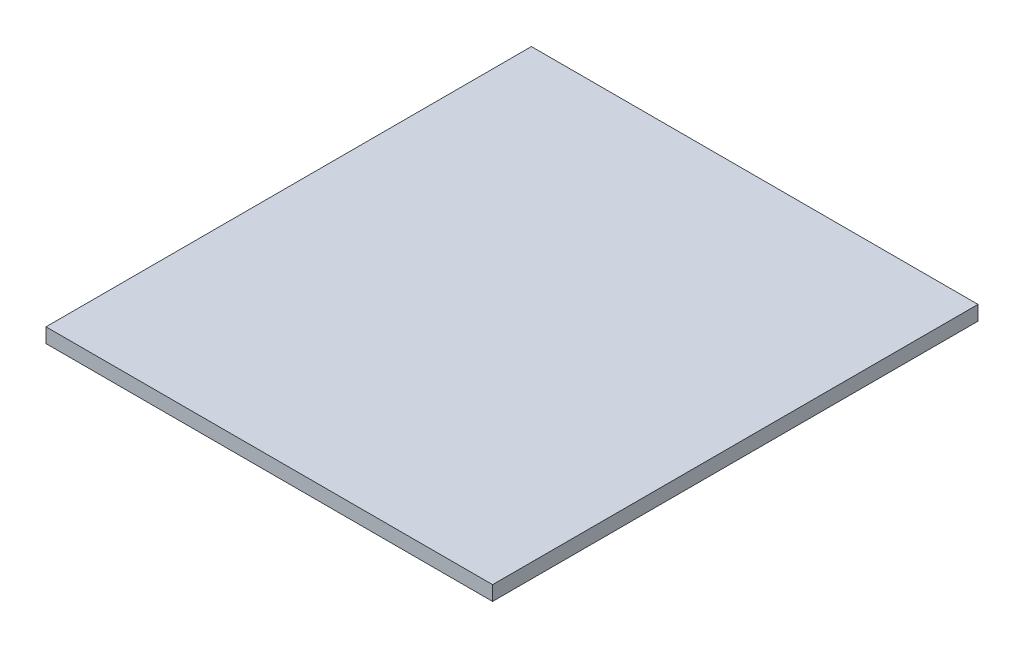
SolidWorks part; units mm, degrees
ref_plane "Front Plane" through (0, 0, 0) normal (0, 0, 1) x (1, 0, 0)
ref_plane "Top Plane" through (0, 0, 0) normal (0, 1, 0) x (1, 0, 0)
ref_plane "Right Plane" through (0, 0, 0) normal (1, 0, 0) x (0, 0, -1)
sketch "Sketch1" plane through (0, 0, 0) normal (0, 1, 0) x (1, 0, 0)
  line L1 (46, -50) -> (-46, -50)
  line L2 (46, -50) -> (46, 50)
  line L3 (46, 50) -> (-46, 50)
  line L4 (-46, -50) -> (-46, 50)
  line L5 (46, -50) -> (-46, 50) construction
  line L6 (46, 50) -> (-46, -50) construction
  point P0 (0, 0)
  dimension "D1" = 100
  dimension "D2" = 92
extrude "Boss-Extrude1" add sketch "Sketch1" along normal blind 3
